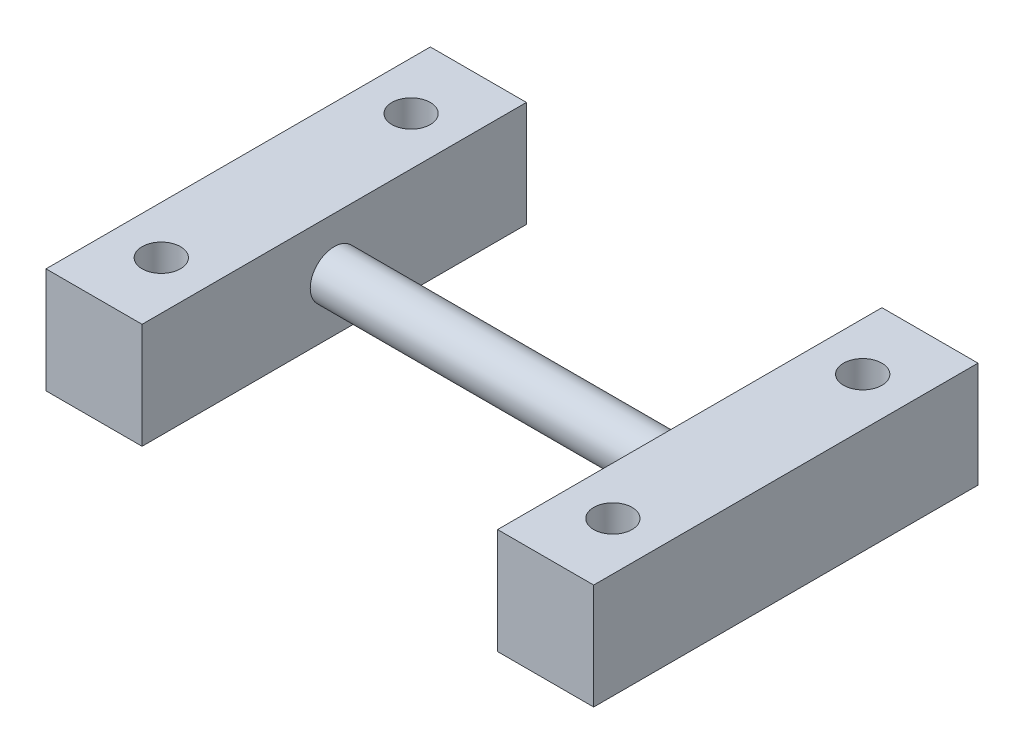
SolidWorks part; units mm, degrees
ref_plane "前视基准面" through (0, 0, 0) normal (0, 0, 1) x (1, 0, 0)
ref_plane "上视基准面" through (0, 0, 0) normal (0, 1, 0) x (1, 0, 0)
ref_plane "右视基准面" through (0, 0, 0) normal (1, 0, 0) x (0, 0, -1)
sketch "草图1" plane through (0, 0, 0) normal (0, 1, 0) x (1, 0, 0)
  line L1 (0, 0) -> (10, 0)
  line L2 (0, 0) -> (0, -40)
  line L3 (0, -40) -> (10, -40)
  line L4 (10, 0) -> (10, -40)
  line L5 (47, 0) -> (57, 0)
  line L6 (47, 0) -> (47, -40)
  line L7 (47, -40) -> (57, -40)
  line L8 (57, 0) -> (57, -40)
  circle A0 centre (5, -7) radius 2
  circle A1 centre (5, -33) radius 2
  circle A2 centre (52, -7) radius 2
  circle A3 centre (52, -33) radius 2
  point P17 (0, -20)
  point P18 (47, -20)
  dimension "D5" = 26
  dimension "D6" = 13
  dimension "D8" = 26
  dimension "D9" = 13
  dimension "D10" = 4
  dimension "D11" = 4
  dimension "D12" = 4
  dimension "D13" = 4
  dimension "D14" = 5
  dimension "D15" = 5
  dimension "D16" = 5
  dimension "D17" = 5
  dimension "D18" = 47
  dimension "D1" = 40
  dimension "D2" = 10
  dimension "D3" = 10
  dimension "D4" = 40
  dimension "D7" = 40
extrude "凸台-拉伸1" add sketch "草图1" along normal blind 22
sketch "草图2" plane through (10, 0, 0) normal (1, 0, 0) x (0, 0, -1)
  line L0 (-40, 22) -> (-40, 0) construction
  line L2 (-40, 0) -> (0, 0) construction
  circle A0 centre (-20, 16.5) radius 2.5
  dimension "D1" = 5
  dimension "D2" = 20
  dimension "D3" = 16.5
extrude "凸台-拉伸2" add sketch "草图2" along normal up to next
ref_plane "基准面1" through (28.5, 0, 0) normal (1, 0, 0) x (0, 0, -1)
sketch "草图3" plane through (0, 0, 0) normal (0, -1, 0) x (1, 0, 0)
  line L1 (0, 40) -> (57, 40)
  line L2 (0, 40) -> (0, 0)
  line L3 (0, 0) -> (57, 0)
  line L4 (57, 40) -> (57, 0)
extrude "切除-拉伸1" cut sketch "草图3" against normal blind 11
